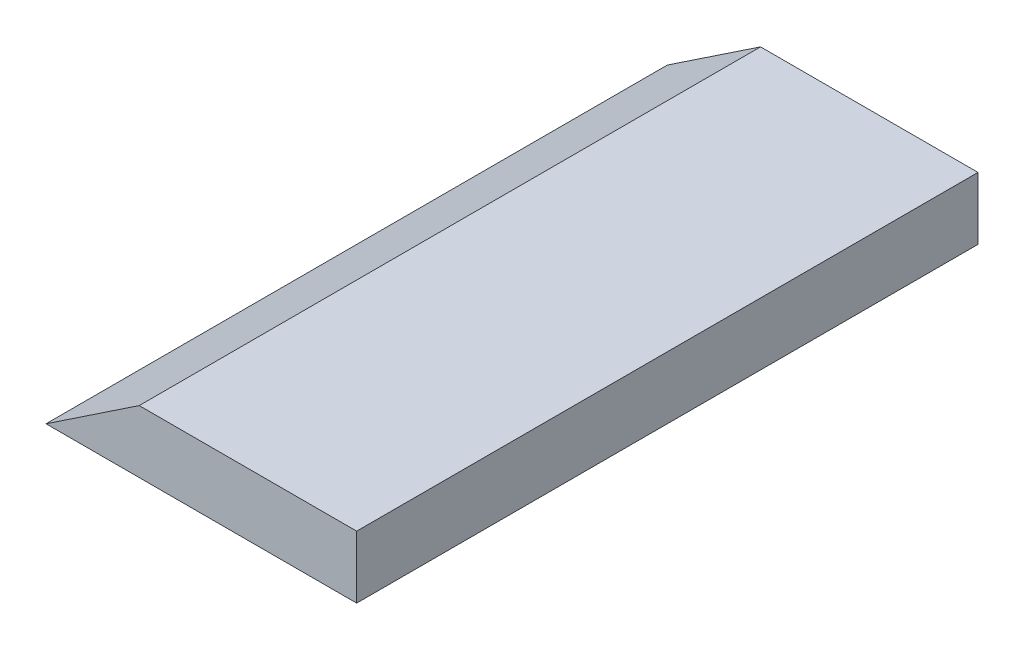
SolidWorks part; units mm, degrees
ref_plane "Plan de face" through (0, 0, 0) normal (0, 0, 1) x (1, 0, 0)
ref_plane "Plan de dessus" through (0, 0, 0) normal (0, 1, 0) x (1, 0, 0)
ref_plane "Plan de droite" through (0, 0, 0) normal (1, 0, 0) x (0, 0, -1)
sketch "Esquisse1" plane through (0, 0, 0) normal (0, 0, 1) x (1, 0, 0)
  line L0 (-29.5317, 0) -> (-24.5317, 0)
  line L1 (-24.5317, 0) -> (-24.5317, 1.0035)
  line L2 (-24.5317, 1.0035) -> (-28.0317, 1.0035)
  line L4 (-29.5317, 0) -> (-28.0317, 1.0035)
extrude "Boss.-Extru.1" add sketch "Esquisse1" along normal blind 10
